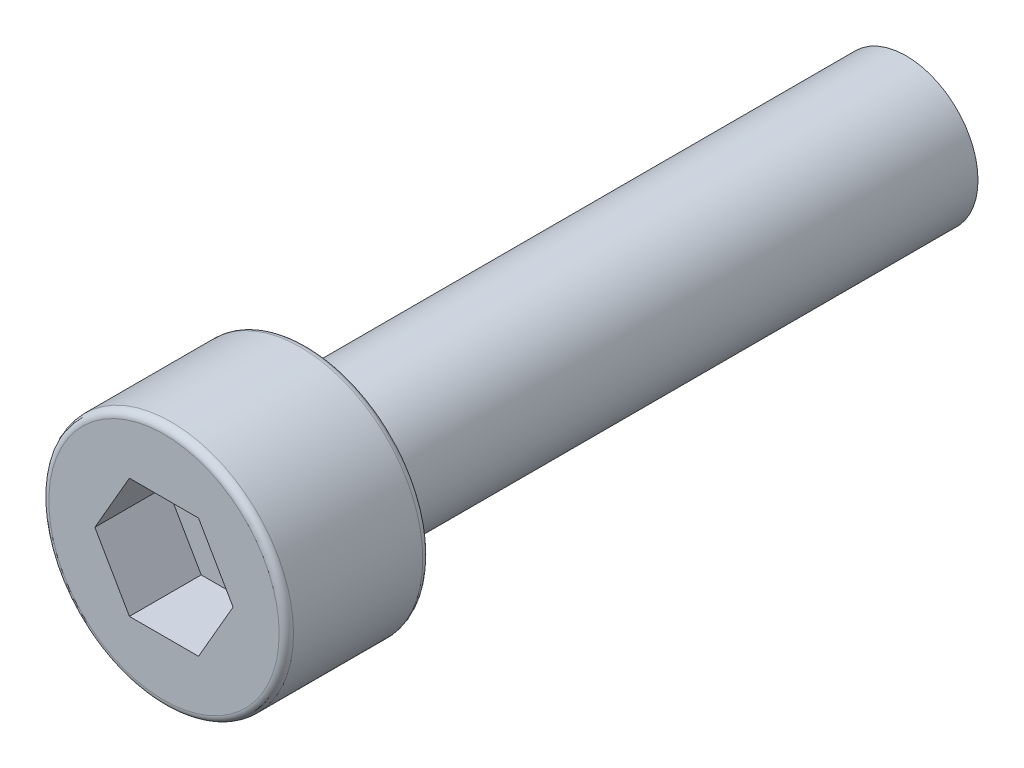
SolidWorks part; units mm, degrees
ref_plane "Front Plane" through (0, 0, 0) normal (1, 0, 0) x (0, 1, 0)
ref_plane "Top Plane" through (0, 0, 0) normal (0, 0, 1) x (0, 1, 0)
ref_plane "Right Plane" through (0, 0, 0) normal (0, 1, 0) x (-1, 0, 0)
sketch "Sketch1" plane through (0, 0, 0) normal (0, 0, 1) x (0, 1, 0)
  circle A0 centre (0, 0) radius 3
  dimension "D1" = 6
extrude "Boss-Extrude1" add sketch "Sketch1" along normal blind 25
sketch "Sketch2" plane through (0, 0, 25) normal (0, 0, 1) x (1, 0, 0)
  circle A0 centre (0, 0) radius 5.11
  dimension "D1" = 10.22
extrude "Boss-Extrude2" add sketch "Sketch2" along normal blind 6
sketch "Sketch3" plane through (0, 0, 31) normal (0, 0, 1) x (1, 0, 0)
  line L1 (2.8868, 0) -> (1.4434, 2.5)
  line L2 (1.4434, 2.5) -> (-1.4434, 2.5)
  line L3 (-1.4434, 2.5) -> (-2.8868, 0)
  line L4 (-2.8868, 0) -> (-1.4434, -2.5)
  line L5 (-1.4434, -2.5) -> (1.4434, -2.5)
  line L6 (1.4434, -2.5) -> (2.8868, 0)
  circle A0 centre (0, 0) radius 2.5 construction
  dimension "D1" = 5
extrude "Cut-Extrude1" cut sketch "Sketch3" against normal blind 3
fillet "Fillet1" radius 0.3 2 edges at (5.11, 0, 25) (5.11, 0, 31)
